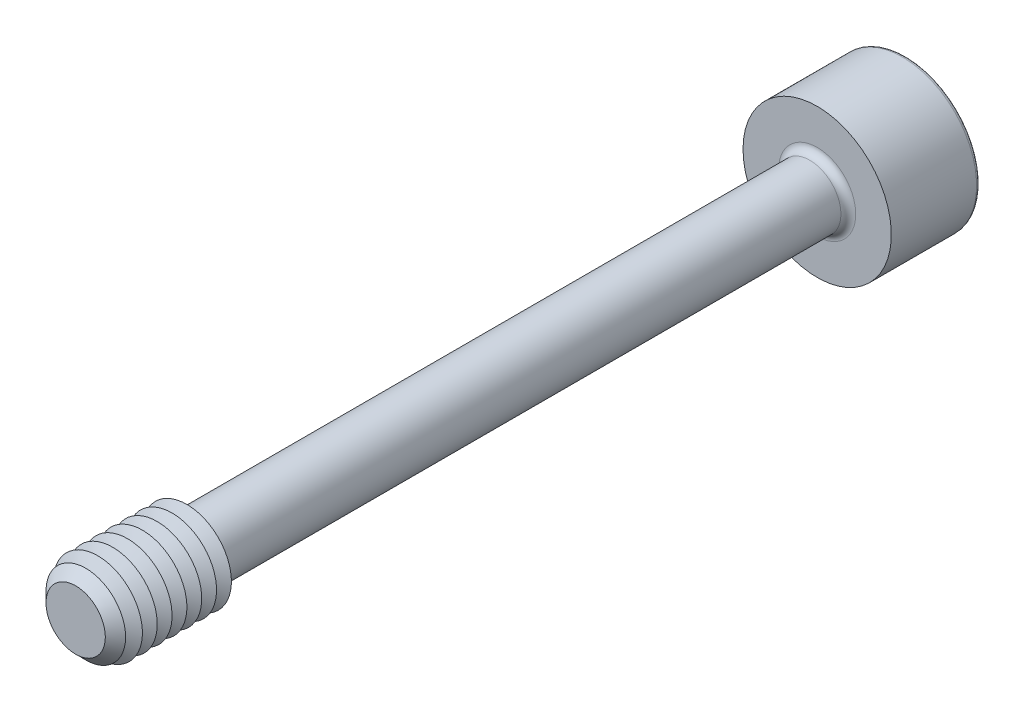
SolidWorks part; units mm, degrees
ref_plane "Front Plane" through (0, 0, 0) normal (0, 0, 1) x (1, 0, 0)
ref_plane "Top Plane" through (0, 0, 0) normal (0, 1, 0) x (1, 0, 0)
ref_plane "Right Plane" through (0, 0, 0) normal (1, 0, 0) x (0, 0, -1)
sketch "Sketch1" plane through (0, 0, 0) normal (0, 0, 1) x (1, 0, 0)
  circle A0 centre (0, 0) radius 2.1
  dimension "D1" = 4.2
extrude "Extrude1" add sketch "Sketch1" along normal mid plane 50
sketch "Sketch2" plane through (0, 0, 0) normal (1, 0, 0) x (0, 0, -1)
  line L0 (-25, 0) -> (-25, 3)
  line L1 (-25, 2.1) -> (-25, -2.1) construction
  line L2 (-25, 3) -> (-17.5, 3)
  line L3 (-17.5, 3) -> (-16.9804, 2.1)
  line L4 (25, 2.1) -> (-25, 2.1) construction
  line L5 (-16.9804, 2.1) -> (-16.9804, 0)
  line L6 (-16.9804, 0) -> (-25, 0)
  dimension "D1" = 3
  dimension "D2" = 120
  dimension "D3" = 7.5
revolve "Revolve1" add sketch "Sketch2" angle 360 about L6
chamfer "Chamfer1" distance 1 angle 45 1 edges at (0, 3, 25)
sketch "Sketch3" plane through (0, 0, -25) normal (0, 0, -1) x (-1, 0, 0)
  circle A0 centre (0, 0) radius 5
  dimension "D1" = 10
extrude "Extrude2" add sketch "Sketch3" along normal blind 6
sketch "Sketch4" plane through (-13.7, 0, -31) normal (0, 0, 1) x (1, 0, 0)
  line L2 (12.2566, -2.5) -> (15.1434, -2.5)
  line L3 (15.1434, -2.5) -> (16.5868, 0)
  line L4 (16.5868, 0) -> (15.1434, 2.5)
  line L6 (15.1434, 2.5) -> (12.2566, 2.5)
  line L7 (12.2566, 2.5) -> (10.8132, 0)
  line L8 (10.8132, 0) -> (12.2566, -2.5)
  circle A0 centre (13.7, 0) radius 2.5 construction
  dimension "D1" = 5
extrude "Extrude3" cut sketch "Sketch4" along normal blind 5
fillet "Fillet1" radius 0.5 1 edges at (-2.1, 0, -25)
fillet "Fillet2" radius 0.25 1 edges at (-5, 0, -31)
sketch "Sketch5" plane through (0, 0, 0) normal (1, 0, 0) x (0, 0, -1)
  line L0 (26, 0) -> (26, -2.5)
  line L1 (26, -2.5) -> (24.5566, 0)
  line L2 (24.5566, 0) -> (26, 0)
  dimension "D1" = 30
revolve "Cut-Revolve1" cut sketch "Sketch5" angle 360 about L2
sketch "Sketch6" plane through (0, 0, 0) normal (1, 0, 0) x (0, 0, -1)
  line L0 (1.332, 0) -> (-13.289, 0) construction
sketch "Sketch7" plane through (0, 0, 0) normal (1, 0, 0) x (0, 0, -1)
  line L0 (-17.5, 3) -> (-18, 2.134)
  line L1 (-18, 2.134) -> (-18.5, 3)
  line L2 (-17.5, 3) -> (-24, 3) construction
  line L3 (-18.5, 3) -> (-17.5, 3)
  dimension "D1" = 1
revolve "Cut-Revolve2" cut sketch "Sketch7" angle 360 about L0
pattern_linear "LPattern1" count 7 spacing 1 along (0, 0, 1) of "Cut-Revolve2"
